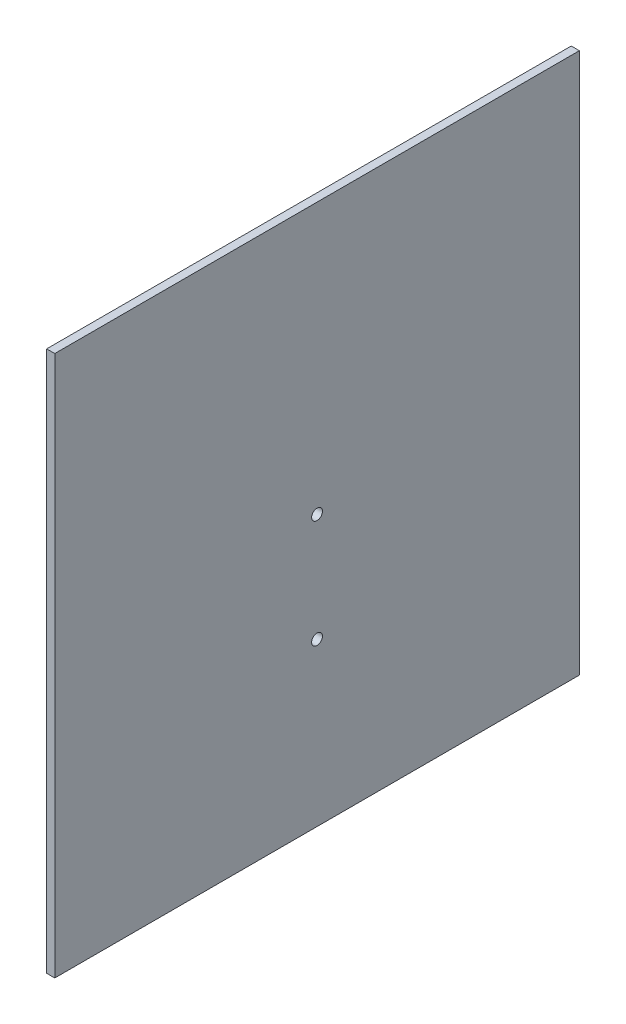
SolidWorks part; units mm, degrees
ref_plane "Vorderansicht" through (0, 0, 0) normal (0, 0, 1) x (1, 0, 0)
ref_plane "Draufsicht" through (0, 0, 0) normal (0, 1, 0) x (1, 0, 0)
ref_plane "Seitenansicht" through (0, 0, 0) normal (1, 0, 0) x (0, 0, -1)
sketch "Skizze1" plane through (0, 0, 0) normal (1, 0, 0) x (0, 0, -1)
  line L0 (0, 0) -> (0, 135.6432) construction
  line L1 (97, 100) -> (-97, 100)
  line L2 (97, 100) -> (97, -100)
  line L3 (97, -100) -> (-97, -100)
  line L4 (-97, 100) -> (-97, -100)
  line L5 (0, 0) -> (174.4074, 0) construction
  dimension "D1" = 194
  dimension "D2" = 200
extrude "Linear austragen1" add sketch "Skizze1" along normal blind 3
sketch "Skizze2" plane through (3, 0, 0) normal (1, 0, 0) x (0, 0, -1)
  circle A0 centre (0, 0) radius 2
extrude "Schnitt-Linear austragen1" cut sketch "Skizze2" against normal blind 20
sketch "Skizze3" plane through (3, 0, 0) normal (1, 0, 0) x (0, 0, -1)
  circle A0 centre (0, -40) radius 2
  dimension "D1" = 4
extrude "Schnitt-Linear austragen2" cut sketch "Skizze3" against normal blind 20
